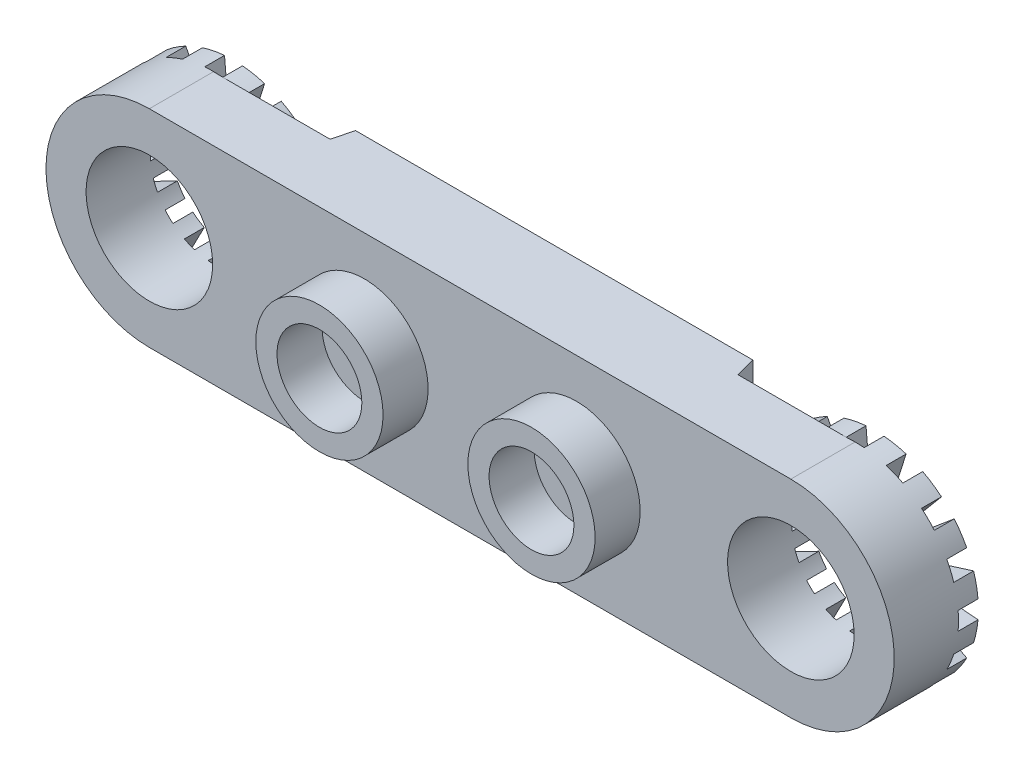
SolidWorks part; units mm, degrees
ref_plane "Front Plane" through (0, 0, 0) normal (0, 0, 1) x (1, 0, 0)
ref_plane "Top Plane" through (0, 0, 0) normal (0, 1, 0) x (1, 0, 0)
ref_plane "Right Plane" through (0, 0, 0) normal (1, 0, 0) x (0, 0, -1)
sketch "Sketch1" plane through (0, 0, 0) normal (0, 0, 1) x (1, 0, 0)
  line L0 (12.1, 3.9) -> (-12.1, 3.9)
  line L1 (0, 0) -> (0, 100.65) construction
  line L2 (0, 0) -> (108.9, 0) construction
  line L3 (-12.1, -3.9) -> (12.1, -3.9)
  arc A0 (12.1, 3.9) -> (12.1, -3.9) centre (12.1, 0) cw
  arc A1 (-12.1, 3.9) -> (-12.1, -3.9) centre (-12.1, 0) ccw
  circle A2 centre (-12.1, 0) radius 2.3876
  circle A3 centre (12.1, 0) radius 2.3876
  dimension "D3" = 4.7752
  dimension "D1" = 24.2
  dimension "D2" = 7.8
extrude "Extrude1" add sketch "Sketch1" along normal mid plane 2.413
sketch "Sketch3" plane through (0, 0, -1.2065) normal (0, 0, -1) x (-1, 0, 0)
  line L0 (-12.1, 3.9) -> (12.1, 3.9) construction
  line L1 (-7.4962, 3.9) -> (7.4962, 3.9)
  line L2 (-7.4962, 3.9) -> (-7.4962, -3.9)
  line L3 (-7.4962, -3.9) -> (7.4962, -3.9)
  line L4 (7.4962, 3.9) -> (7.4962, -3.9)
  line L5 (12.1, -3.9) -> (-12.1, -3.9) construction
  line L6 (0, -10.9375) -> (0, 8.6806) construction
  circle A0 centre (-12.1, 0) radius 2.3876 construction
  dimension "D1" = 4.6038
extrude "Extrude2" add sketch "Sketch3" along normal blind 0.762
chamfer "Chamfer1" distance 0.2 distance2 0.76 2 edges
sketch "Sketch5" plane through (0, 0, 1.2065) normal (0, 0, 1) x (1, 0, 0)
  line L0 (0, 10.9809) -> (0, -10.6771) construction
  line L1 (-14.1059, 0) -> (14.9306, 0) construction
  line L2 (0.922, 2.1833) -> (0.922, 0.922)
  line L3 (0.922, 0.922) -> (2.1833, 0.922)
  line L4 (2.1833, -0.922) -> (0.922, -0.922)
  line L5 (0.922, -0.922) -> (0.922, -2.1833)
  line L6 (-0.922, -2.1833) -> (-0.922, -0.922)
  line L7 (-0.922, -0.922) -> (-2.1833, -0.922)
  line L8 (-2.1833, 0.922) -> (-0.922, 0.922)
  line L9 (-0.922, 0.922) -> (-0.922, 2.1833)
  circle A0 centre (0, 0) radius 2.37 construction
  arc A1 (-0.922, 2.1833) -> (0.922, 2.1833) centre (0, 0.0087) cw
  arc A2 (-2.1833, 0.922) -> (-2.1833, -0.922) centre (-0.0087, 0) ccw
  arc A3 (2.1833, 0.922) -> (2.1833, -0.922) centre (0.0087, 0) cw
  arc A4 (-0.922, -2.1833) -> (0.922, -2.1833) centre (0, -0.0087) ccw
  dimension "D5" = 4.74
  dimension "D6" = 2.362
  dimension "D7" = 2.362
  dimension "D8" = 2.362
  dimension "D9" = 2.362
  dimension "D1" = 0.922
  dimension "D2" = 0.922
  dimension "D3" = 0.922
  dimension "D4" = 0.922
sketch "Sketch7" plane through (0, 0, -1.2065) normal (0, 0, -1) x (-1, 0, 0)
  circle A0 centre (-12.1, 0) radius 3.9
  arc A1 (-15.1741, 2.4) -> (-15.1741, -2.4) centre (-12.1, 0) ccw construction
  circle A2 centre (-12.1, 0) radius 2.3876
  circle A3 centre (-12.1, 0) radius 2.3876 construction
extrude "Extrude4" add sketch "Sketch7" along normal up to surface (0.762 mm away)
sketch "Sketch8" plane through (0, 0, -1.9685) normal (0, 0, -1) x (-1, 0, 0)
  line L0 (-12.1, 5.2243) -> (-12.1, 0) construction
  line L1 (-12.1, 0) -> (-11.6317, 5.3532) construction
  line L2 (-12.1, 0) -> (-12.5867, 5.5628) construction
  line L3 (-12.3081, 2.3785) -> (-12.4399, 3.8852)
  line L4 (-11.8919, 2.3785) -> (-11.7601, 3.8852)
  circle A1 centre (-12.1, 0) radius 2.3876 construction
  arc A2 (-12.4399, 3.8852) -> (-11.7601, 3.8852) centre (-12.1, 0) cw
  arc A3 (-12.3081, 2.3785) -> (-11.8919, 2.3785) centre (-12.1, 0) cw
  circle A4 centre (-12.1, 0) radius 3.9 construction
  dimension "D1" = 5
  dimension "D2" = 5
extrude "Cut-Extrude3" cut sketch "Sketch8" against normal blind 0.75
pattern_circular "CirPattern1" count 16 over 360 about axis through (12.1, 0, 0) along (0, 0, 1) of "Cut-Extrude3"
mirror "Mirror2" about plane through (0, 0, 0) normal (1, 0, 0) of "CirPattern1", "Cut-Extrude3", "Extrude4"
sketch "Sketch9" plane through (0, 0, 1.2065) normal (0, 0, 1) x (1, 0, 0)
  line L0 (-12.1, 0) -> (22.7817, 0) construction
sketch "Sketch10" plane through (0, 0, -1.9685) normal (0, 0, -1) x (-1, 0, 0)
  line L0 (-7.4962, -3.9) -> (7.4962, -3.9) construction
  line L1 (-6.4162, 2.35) -> (6.3838, 2.35)
  line L2 (-6.4162, 2.35) -> (-6.4162, -2.35)
  line L3 (-6.4162, -2.35) -> (6.3838, -2.35)
  line L4 (6.3838, 2.35) -> (6.3838, -2.35)
  line L5 (-7.4962, 3.9) -> (-7.4962, -3.9) construction
  dimension "D1" = 12.8
  dimension "D2" = 4.7
  dimension "D3" = 1.55
  dimension "D4" = 1.08
extrude "Cut-Extrude4" cut sketch "Sketch10" against normal blind 1.7
sketch "Sketch11" plane through (0, 0, -0.2685) normal (0, 0, -1) x (-1, 0, 0)
  line L0 (-6.4162, 2.35) -> (6.3838, -2.35) construction
  line L1 (-6.4162, -2.35) -> (6.3838, 2.35) construction
  circle A0 centre (-0.0162, 0) radius 1.5
  dimension "D1" = 3
extrude "Boss-Extrude1" add sketch "Sketch11" along normal blind 1.7
sketch "Sketch12" plane through (0, 0, 1.2065) normal (0, 0, 1) x (1, 0, 0)
  line L0 (-12.1, 0) -> (12.1, 0) construction
  circle A0 centre (-3.9838, 0) radius 2.4
  circle A1 centre (4.0162, 0) radius 2.4
  circle A2 centre (0.0162, 0) radius 1.5 construction
  dimension "D1" = 8
  dimension "D2" = 4.8
  dimension "D3" = 4.8
  dimension "D4" = 4
extrude "Boss-Extrude2" add sketch "Sketch12" along normal blind 1.7
sketch "Sketch13" plane through (0, 0, 2.9065) normal (0, 0, 1) x (1, 0, 0)
  circle A0 centre (-3.9838, 0) radius 1.6
  circle A1 centre (4.0162, 0) radius 1.6
  dimension "D1" = 3.2
  dimension "D2" = 3.2
extrude "Cut-Extrude5" cut sketch "Sketch13" against normal blind 1.7
